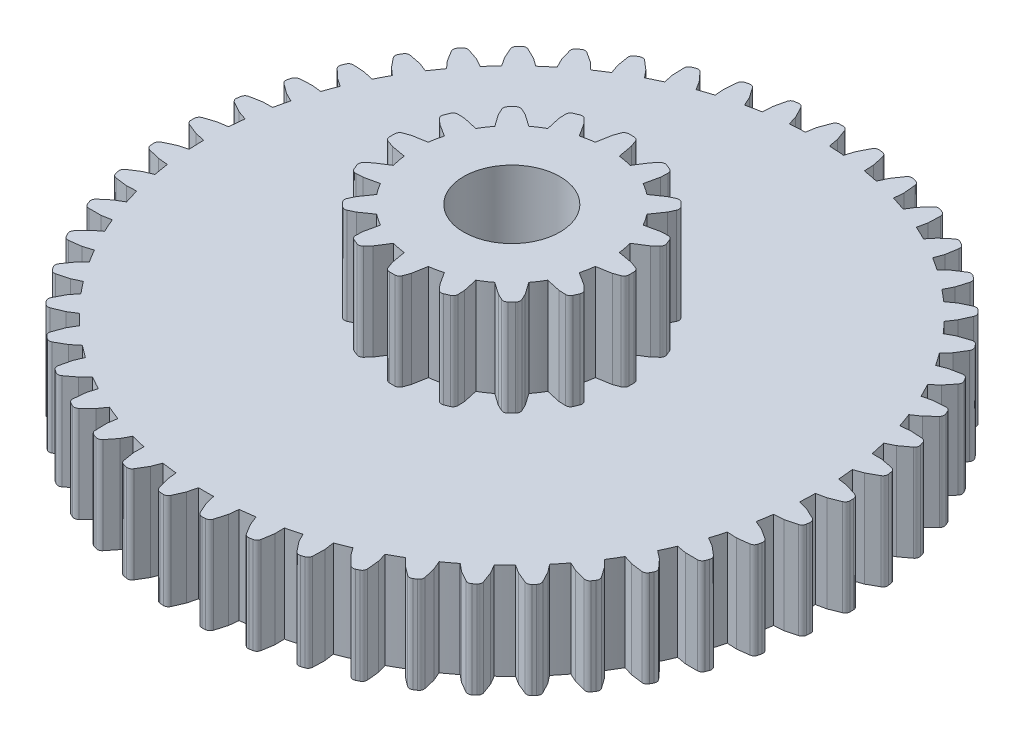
SolidWorks part; units mm, degrees
ref_plane "Front Plane" through (0, 0, 0) normal (0, 0, 1) x (1, 0, 0)
ref_plane "Top Plane" through (0, 0, 0) normal (0, 1, 0) x (1, 0, 0)
ref_plane "Right Plane" through (0, 0, 0) normal (1, 0, 0) x (0, 0, -1)
sketch "Sketch1" plane through (0, 0, 0) normal (0, 1, 0) x (1, 0, 0)
  circle A0 centre (0, 0) radius 80.6704
  circle A1 centre (0, 0) radius 12.7
  dimension "D1" = 25.4
  dimension "D2" = 161.3408
extrude "Boss-Extrude1" add sketch "Sketch1" along normal blind 25.4
sketch "Sketch2" plane through (0, 25.4, 0) normal (0, 1, 0) x (1, 0, 0)
  line L0 (-3.175, 80.6079) -> (3.175, 80.6079)
  line L1 (3.175, 80.6079) -> (2.7271, 83.1479)
  line L2 (2.7271, 83.1479) -> (1.3404, 86.9579)
  line L3 (1.3404, 86.9579) -> (-1.3404, 86.9579)
  line L4 (-1.3404, 86.9579) -> (-2.7271, 83.1479)
  line L5 (-2.7271, 83.1479) -> (-3.175, 80.6079)
  circle A0 centre (0, 0) radius 80.6704 construction
  dimension "D1" = 80
  dimension "D2" = 110
  dimension "D3" = 6.35
  dimension "D4" = 2.54
  dimension "D5" = 3.81
extrude "Boss-Extrude2" add sketch "Sketch2" against normal blind 25.4
fillet "Fillet1" radius 1.27 2 edges at (1.3404, 12.7, -86.9579) (-1.3404, 12.7, -86.9579)
pattern_circular "CirPattern1" count 49 over 360 about axis through (0, 0, 0) along (0, 1, 0) of "Fillet1", "Boss-Extrude2"
sketch "Sketch3" plane through (0, 25.4, 0) normal (0, 1, 0) x (1, 0, 0)
  circle A0 centre (0, 0) radius 25.4
  circle A1 centre (0, 0) radius 12.7
  circle A2 centre (0, 0) radius 12.7 construction
  dimension "D1" = 50.8
extrude "Boss-Extrude3" add sketch "Sketch3" along normal blind 25.4
sketch "Sketch4" plane through (0, 50.8, 0) normal (0, 1, 0) x (1, 0, 0)
  line L0 (-3.175, 25.2008) -> (3.175, 25.2008)
  line L1 (3.175, 25.2008) -> (2.5032, 29.0108)
  line L2 (2.5032, 29.0108) -> (1.8829, 30.7151)
  line L3 (0.6894, 31.5508) -> (-0.6894, 31.5508)
  line L4 (-1.8829, 30.7151) -> (-2.5032, 29.0108)
  line L5 (-2.5032, 29.0108) -> (-3.175, 25.2008)
  circle A0 centre (0, 0) radius 25.4 construction
  arc A1 (0.6894, 31.5508) -> (1.8829, 30.7151) centre (0.6894, 30.2808) cw
  arc A2 (-0.6894, 31.5508) -> (-1.8829, 30.7151) centre (-0.6894, 30.2808) ccw
  point P11 (1.5787, 31.5508)
  dimension "D6" = 1.27
  dimension "D1" = 80
  dimension "D2" = 110
  dimension "D3" = 3.81
  dimension "D4" = 2.54
  dimension "D5" = 6.35
extrude "Boss-Extrude4" add sketch "Sketch4" against normal blind 25.4
pattern_circular "CirPattern2" count 16 over 360 about axis through (0, 0, 0) along (0, 1, 0) of "Boss-Extrude4"
